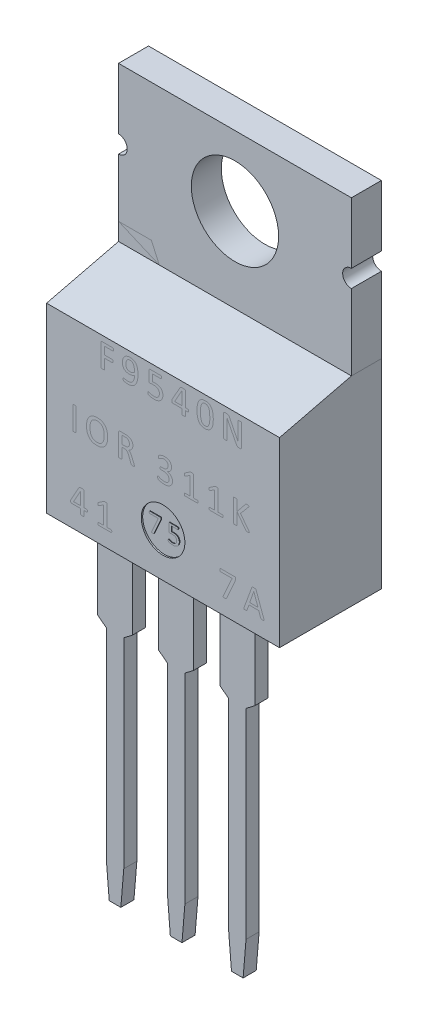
SolidWorks part; units mm, degrees
other "Body"
other "Heat Sink"
other "Drain"
other "Gate"
other "Source"
ref_plane "Front Plane" through (0, 0, 0) normal (0, 0, 1) x (1, 0, 0)
ref_plane "Top Plane" through (0, 0, 0) normal (0, 1, 0) x (1, 0, 0)
ref_plane "Right Plane" through (0, 0, 0) normal (1, 0, 0) x (0, 0, -1)
sketch "Sketch1" plane through (0, 0, 0) normal (0, 0, 1) x (1, 0, 0)
  line L1 (-5.08, 4.7308) -> (5.08, 4.7308)
  line L2 (-5.08, 4.7308) -> (-5.08, -4.7307)
  line L3 (-5.08, -4.7307) -> (5.08, -4.7307)
  line L4 (5.08, 4.7308) -> (5.08, -4.7307)
  line L5 (-5.08, 4.7308) -> (5.08, -4.7307) construction
  line L6 (-5.08, -4.7307) -> (5.08, 4.7308) construction
  point P1 (0, 0)
  dimension "D1" = 10.16
  dimension "D2" = 9.4615
extrude "Boss-Extrude1" add sketch "Sketch1" along normal blind 4.445
sketch "Sketch2" plane through (0, 0, 0) normal (0, 0, -1) x (-1, 0, 0)
  line L0 (0, 2.3019) -> (0, -1.4062) construction
  line L1 (-3.302, 4.7308) -> (-3.302, 2.5718)
  line L2 (-3.302, 2.5718) -> (-4.445, 2.5718)
  line L3 (-4.445, 2.5718) -> (-4.6113, -2.1907)
  line L4 (-5.08, 4.7308) -> (-5.08, -4.7307)
  line L5 (-5.08, -4.7307) -> (5.08, -4.7307)
  line L6 (5.08, -4.7307) -> (5.08, 4.7308)
  line L7 (5.08, 4.7308) -> (-5.08, 4.7308)
  line L8 (-5.08, 4.7308) -> (-5.08, -4.7307)
  line L9 (-5.08, -4.7307) -> (5.08, -4.7307)
  line L10 (5.08, -4.7307) -> (5.08, 4.7308)
  line L11 (5.08, 4.7308) -> (-5.08, 4.7308)
  line L12 (-4.6113, -2.1907) -> (4.6113, -2.1907)
  line L13 (4.445, 2.5718) -> (4.6113, -2.1907)
  line L14 (3.302, 2.5718) -> (4.445, 2.5718)
  line L15 (3.302, 4.7308) -> (3.302, 2.5718)
  point P13 (0, -2.1907)
  dimension "D2" = 2.54
  dimension "D3" = 1.778
  dimension "D4" = 1.143
  dimension "D5" = 92
  dimension "D6" = 2.159
  dimension "D1" = 0
extrude "Cut-Extrude1" cut sketch "Sketch2" against normal blind 1.3081
sketch "Sketch3" plane through (0, 0, 0) normal (0, 0, 1) x (1, 0, 0)
  line L0 (3.302, 4.7308) -> (3.302, 2.5718) construction
  line L1 (3.302, 2.5718) -> (4.445, 2.5718) construction
  line L2 (4.445, 2.5718) -> (4.6113, -2.1907) construction
  line L3 (4.6113, -2.1907) -> (-4.6113, -2.1907) construction
  line L4 (-4.445, 2.5718) -> (-4.6113, -2.1907) construction
  line L5 (-3.302, 2.5718) -> (-4.445, 2.5718) construction
  line L6 (-3.302, 4.7308) -> (-3.302, 2.5718) construction
  line L7 (3.302, 3.9688) -> (3.302, 2.5718)
  line L8 (3.302, 2.5718) -> (4.445, 2.5718)
  line L9 (4.445, 2.5718) -> (4.6113, -2.1907)
  line L10 (4.6113, -2.1907) -> (-4.6113, -2.1907)
  line L11 (-4.445, 2.5718) -> (-4.6113, -2.1907)
  line L12 (-3.302, 2.5718) -> (-4.445, 2.5718)
  line L13 (-3.302, 3.9688) -> (-3.302, 2.5718)
  line L14 (5.08, 4.7308) -> (3.302, 4.7308) construction
  line L16 (5.08, 3.9688) -> (3.302, 3.9688)
  line L17 (-3.302, 3.9688) -> (-5.08, 3.9688)
  line L18 (5.08, 3.9688) -> (5.08, 10.6998)
  line L19 (-5.08, 3.9688) -> (-5.08, 10.6998)
  line L20 (5.08, 10.6998) -> (-5.08, 10.6998)
  dimension "D1" = 6.731
  dimension "D2" = 0.762
sketch "Sketch4" plane through (5.08, 0, 0) normal (1, 0, 0) x (0, 0, -1)
  line L0 (-4.445, 4.7308) -> (-1.3081, 4.7308)
  line L1 (-4.445, 4.7308) -> (0, 4.7308) construction
  line L2 (-1.3081, 4.7308) -> (-1.3081, 3.9688)
  line L3 (-1.3081, 3.9688) -> (-4.445, 3.2068)
  line L4 (-4.445, -4.7307) -> (-4.445, 4.7308) construction
  line L5 (-4.445, 3.2068) -> (-4.445, 4.7308)
  line L6 (0, 3.9688) -> (0, 2.5718) construction
  dimension "D1" = 1.3081
  dimension "D2" = 1.524
  dimension "D3" = 0.762
extrude "Cut-Extrude2" cut sketch "Sketch4" against normal through all
extrude "Boss-Extrude2" add sketch "Sketch3" along normal up to surface (1.3081 mm away) separate body
sketch "Sketch5" plane through (0, 0, 1.3081) normal (0, 0, 1) x (1, 0, 0)
  line L0 (-5.08, 10.6998) -> (5.08, 10.6998) construction
  circle A0 centre (0, 7.6518) radius 1.905
  point P4 (0, 10.6998)
  dimension "D1" = 3.81
  dimension "D2" = 3.048
extrude "Cut-Extrude3" cut sketch "Sketch5" against normal through all
sketch "Sketch6" plane through (0, 0, 1.3081) normal (0, 0, 1) x (1, 0, 0)
  line L0 (-5.08, 3.9688) -> (-5.08, 10.6998) construction
  line L1 (0, 9.8553) -> (0, 7.3411) construction
  circle A0 centre (-5.08, 7.6518) radius 0.381
  circle A1 centre (5.08, 7.6518) radius 0.381
  dimension "D1" = 0.762
extrude "Cut-Extrude4" cut sketch "Sketch6" against normal through all
sketch "Sketch7" plane through (0, -4.7307, 0) normal (0, -1, 0) x (1, 0, 0)
  line L1 (-0.762, 3.8735) -> (0.762, 3.8735)
  line L2 (-0.762, 3.8735) -> (-0.762, 3.302)
  line L3 (-0.762, 3.302) -> (0.762, 3.302)
  line L4 (0.762, 3.8735) -> (0.762, 3.302)
  point P4 (0, 3.302)
  dimension "D1" = 0.5715
  dimension "D2" = 1.524
  dimension "D3" = 3.302
extrude "Boss-Extrude3" add sketch "Sketch7" along normal blind 13.843 separate body
sketch "Sketch8" plane through (0, 0, 3.8735) normal (0, 0, 1) x (1, 0, 0)
  line L0 (0, -4.7307) -> (0, -18.5737) construction
  line L1 (0.762, -4.7307) -> (-0.762, -4.7307) construction
  line L2 (0.762, -18.5737) -> (-0.762, -18.5737) construction
  line L3 (0.254, -18.5737) -> (-0.254, -18.5737)
  line L4 (-0.254, -18.5737) -> (-0.381, -17.0497)
  line L5 (-0.381, -17.0497) -> (-0.381, -8.3248)
  line L6 (-0.381, -8.3248) -> (-0.762, -8.0327)
  line L7 (-0.762, -18.5737) -> (-0.762, -4.7307) construction
  line L8 (-0.762, -8.0327) -> (-0.762, -4.7307)
  line L9 (-0.762, -4.7307) -> (0.762, -4.7307)
  line L10 (0.762, -8.0327) -> (0.762, -4.7307)
  line L11 (0.381, -8.3248) -> (0.762, -8.0327)
  line L12 (0.381, -17.0497) -> (0.381, -8.3248)
  line L13 (0.254, -18.5737) -> (0.381, -17.0497)
  line L18 (0.762, -4.7307) -> (-0.762, -4.7307)
  line L19 (-0.762, -4.7307) -> (-0.762, -18.5737)
  line L20 (-0.762, -18.5737) -> (0.762, -18.5737)
  line L21 (0.762, -18.5737) -> (0.762, -4.7307)
  line L22 (0.762, -4.7307) -> (-0.762, -4.7307)
  line L23 (-0.762, -4.7307) -> (-0.762, -18.5737)
  line L24 (-0.762, -18.5737) -> (0.762, -18.5737)
  line L25 (0.762, -18.5737) -> (0.762, -4.7307)
  dimension "D1" = 0.254
  dimension "D2" = 1.524
  dimension "D3" = 0.381
  dimension "D4" = 8.7249
  dimension "D5" = 3.302
  dimension "D6" = 0
extrude "Cut-Extrude5" cut sketch "Sketch8" against normal through all contours L5 L6 L4 M6 M7 | L13 L11 L12 M7 M8
move or copy body "Body-Move/Copy1" bodies to move or copy 108 copy yes number of copies 1 translate (2.667, 0, 0)
move or copy body "Body-Move/Copy2" bodies to move or copy 108 copy yes number of copies 1 translate (-2.667, 0, 0)
sketch "Sketch9" plane through (0, 0, 4.445) normal (0, 0, 1) x (1, 0, 0)
  line L0 (-5.08, -4.7307) -> (5.08, -4.7307) construction
  circle A0 centre (0, -2.8257) radius 0.9525
  dimension "D1" = 1.905
  dimension "D2" = 1.905
extrude "Cut-Extrude6" cut sketch "Sketch9" against normal blind 0.0635
sketch "Sketch10" plane through (0, 0, 4.3815) normal (0, 0, 1) x (1, 0, 0)
  line L0 (-5.08, -4.7307) -> (5.08, -4.7307) construction
  line L1 (-5.08, 3.2068) -> (-5.08, -4.7307) construction
  text T0 "75" font "Calibri" height in points 3
  dimension "D1" = 1.524
  dimension "D2" = 4.3815
wrap "Wrap1" sketch "Sketch10" source sketch "Sketch10" thickness 0.0254 parameters "D1"=0.0254
sketch "Sketch11" plane through (0, 0, 4.445) normal (0, 0, 1) x (1, 0, 0)
  text T0 "  F9540N  IOR 311K  41       7A" font "Calibri" height in points 4
wrap "Wrap2" sketch "Sketch11" wrap type scribe source sketch "Sketch11"
